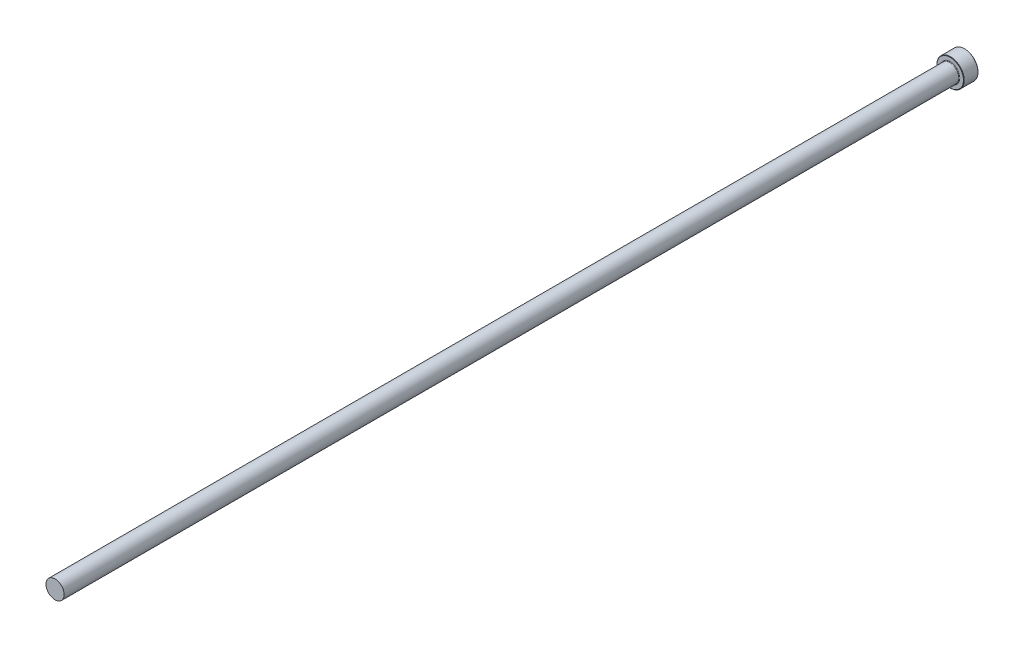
SolidWorks part; units mm, degrees
ref_plane "Front Plane" through (0, 0, 0) normal (0, 0, 1) x (1, 0, 0)
ref_plane "Top Plane" through (0, 0, 0) normal (0, 1, 0) x (1, 0, 0)
ref_plane "Right Plane" through (0, 0, 0) normal (1, 0, 0) x (0, 0, -1)
sketch "Sketch1" plane through (0, 0, 0) normal (1, 0, 0) x (0, 0, -1)
  line L0 (0, 0) -> (0, 7.5)
  line L1 (0, 8.25) -> (0, -8.25) construction
  line L2 (0, 7.5) -> (-8, 7.5)
  line L3 (-8, 7.5) -> (-8, 5.3)
  line L4 (-8.3, 5) -> (-500, 5)
  line L5 (-500, 5) -> (-500, 0)
  line L6 (8.25, 0) -> (-8.25, 0) construction
  line L7 (-500, 0) -> (0, 0)
  line L8 (-109.0506, 0) -> (16.9928, 0) construction
  arc A0 (-8, 5.3) -> (-8.3, 5) centre (-8.3, 5.3) cw
  dimension "D1" = 0.3
  dimension "D2" = 15
  dimension "D3" = 10
  dimension "D4" = 500
  dimension "D5" = 8
revolve "Revolve1" add sketch "Sketch1" angle 360 about L8
chamfer "Chamfer1" distance 0.2 angle 45 2 edges at (7.5, 0, 0) (7.5, 0, 8)
